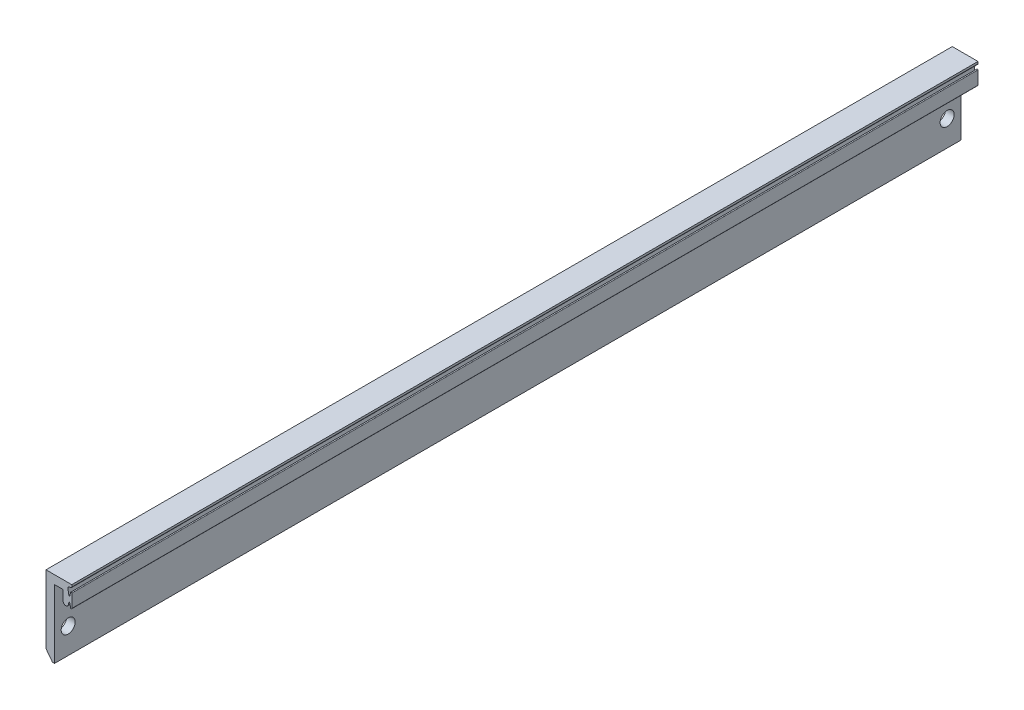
SolidWorks part; units mm, degrees
ref_plane "前视基准面" through (0, 0, 0) normal (0, 0, 1) x (1, 0, 0)
ref_plane "上视基准面" through (0, 0, 0) normal (0, 1, 0) x (1, 0, 0)
ref_plane "右视基准面" through (0, 0, 0) normal (1, 0, 0) x (0, 0, -1)
sketch "草图1" plane through (0, 0, 0) normal (0, 0, 1) x (1, 0, 0)
  line L1704 (2468.3526, -3235.8771) -> (2475.8926, -3235.8771)
  line L1705 (2470.8526, -3238.3771) -> (2473.3526, -3238.3771)
  line L1706 (2468.3526, -3235.8771) -> (2468.3526, -3255.8771)
  line L1707 (2470.8526, -3238.3771) -> (2470.8526, -3258.3771)
  line L1708 (2470.8526, -3258.3771) -> (2470.2526, -3258.3771)
  line L1709 (2468.3526, -3255.8771) -> (2470.2526, -3258.3771)
  line L1710 (2473.3526, -3238.3771) -> (2473.3526, -3241.2434)
  line L1711 (2473.3526, -3238.3771) -> (2473.3526, -3241.2938)
  line L1712 (2475.8926, -3238.0396) -> (2475.8926, -3241.8646)
  line L1713 (2474.9017, -3241.456) -> (2475.0378, -3240.8129)
  line L1714 (2475.8926, -3238.0529) -> (2475.8926, -3241.9013)
  line L1715 (2475.0915, -3236.8368) -> (2475.6405, -3236.7479)
  line L1716 (2475.3296, -3240.8224) -> (2475.5558, -3241.9417)
  line L1717 (2475.5569, -3238.0076) -> (2475.3287, -3238.9862)
  line L1718 (2475.8926, -3235.8771) -> (2475.8926, -3236.4518)
  arc A580 (2474.8396, -3237.1209) -> (2475.0336, -3238.9696) centre (2481.2807, -3237.3796) ccw
  arc A581 (2475.6405, -3236.7479) -> (2475.8926, -3236.4518) centre (2475.5926, -3236.4518) ccw
  arc A582 (2475.0915, -3236.8368) -> (2474.8396, -3237.1209) centre (2475.1394, -3237.133) ccw
  arc A583 (2475.3296, -3240.8224) -> (2475.0343, -3240.8293) centre (2475.1826, -3240.8521) ccw
  arc A584 (2475.5558, -3241.9417) -> (2475.8926, -3241.9013) centre (2475.7226, -3241.908) ccw
  arc A585 (2475.0336, -3238.9696) -> (2475.3287, -3238.9862) centre (2475.1826, -3238.9521) ccw
  arc A586 (2475.8926, -3238.0529) -> (2475.5569, -3238.0076) centre (2475.7226, -3238.0462) ccw
  arc A587 (2473.3526, -3241.2938) -> (2474.9017, -3241.456) centre (2474.1356, -3241.2938) ccw
extrude "凸台-拉伸1" add sketch "草图1" along normal mid plane 265.35 contours L1711 A587 L1713 A583 L1716 A584 L1714 L1712 A586 L1717 A585 A580 A582 L1715 A581 L1718 L1704 L1706 L1709 L1708 L1707 L1705 L1710
sketch "草图2" plane through (2468.3526, 0, 0) normal (-1, 0, 0) x (0, 0, 1)
  line L0 (-132.675, -3235.8771) -> (-132.675, -3255.8771) construction
  line L1 (132.675, -3235.8771) -> (-132.675, -3235.8771) construction
  line L2 (0, -3235.8771) -> (0, -3258.3771) construction
  line L3 (132.675, -3258.3771) -> (-132.675, -3258.3771) construction
  circle A0 centre (-128.675, -3250.8771) radius 2.05
  circle A1 centre (128.675, -3250.8771) radius 2.05
  dimension "D1" = 4.1
  dimension "D2" = 4
  dimension "D3" = 15
extrude "切除-拉伸1" cut sketch "草图2" against normal through all
equation "\"切除-拉伸2\" = if ( \"D1@凸台-拉伸1\" = 265.35 , \"unsuppressed\" , \"suppressed\" )"
